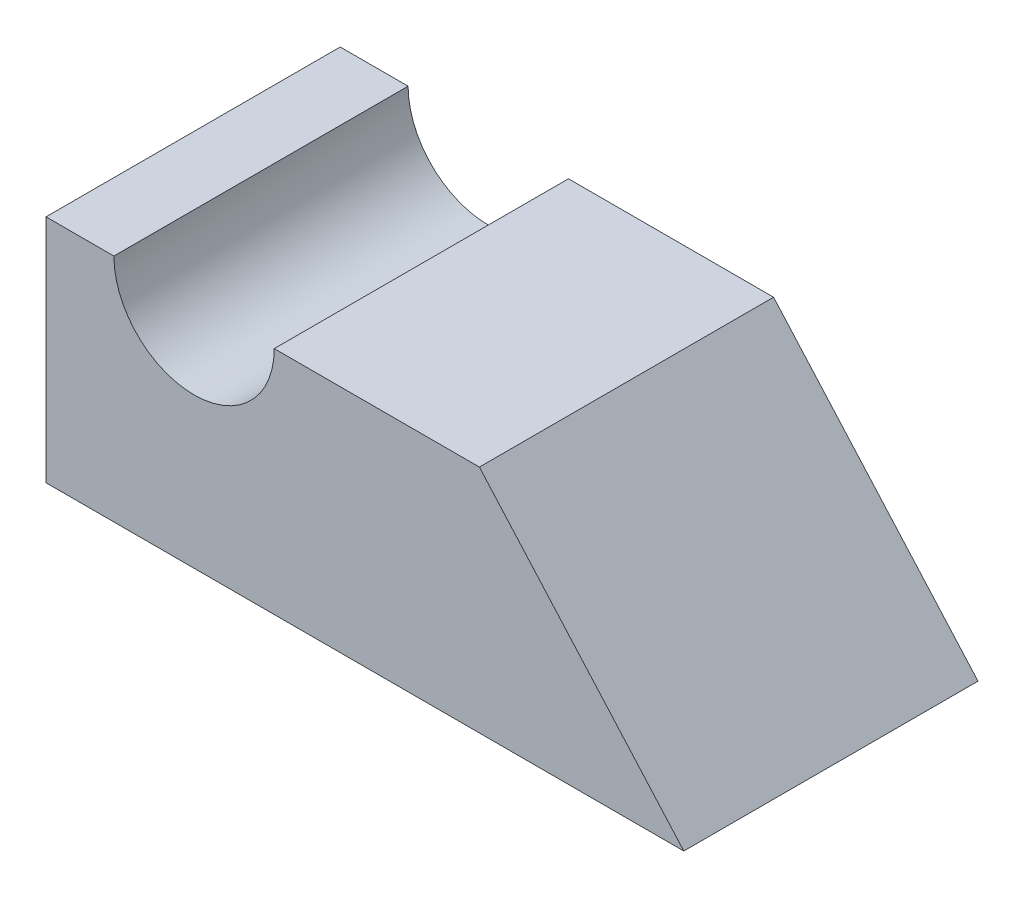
SolidWorks part; units mm, degrees
ref_plane "Front Plane" through (0, 0, 0) normal (0, 0, 1) x (1, 0, 0)
ref_plane "Top Plane" through (0, 0, 0) normal (0, 1, 0) x (1, 0, 0)
ref_plane "Right Plane" through (0, 0, 0) normal (1, 0, 0) x (0, 0, -1)
sketch "Sketch1"
extrude "Extrude1" add sketch "Sketch1" along normal blind 101
sketch "Sketch2"
  dimension "Thickness" = 2
